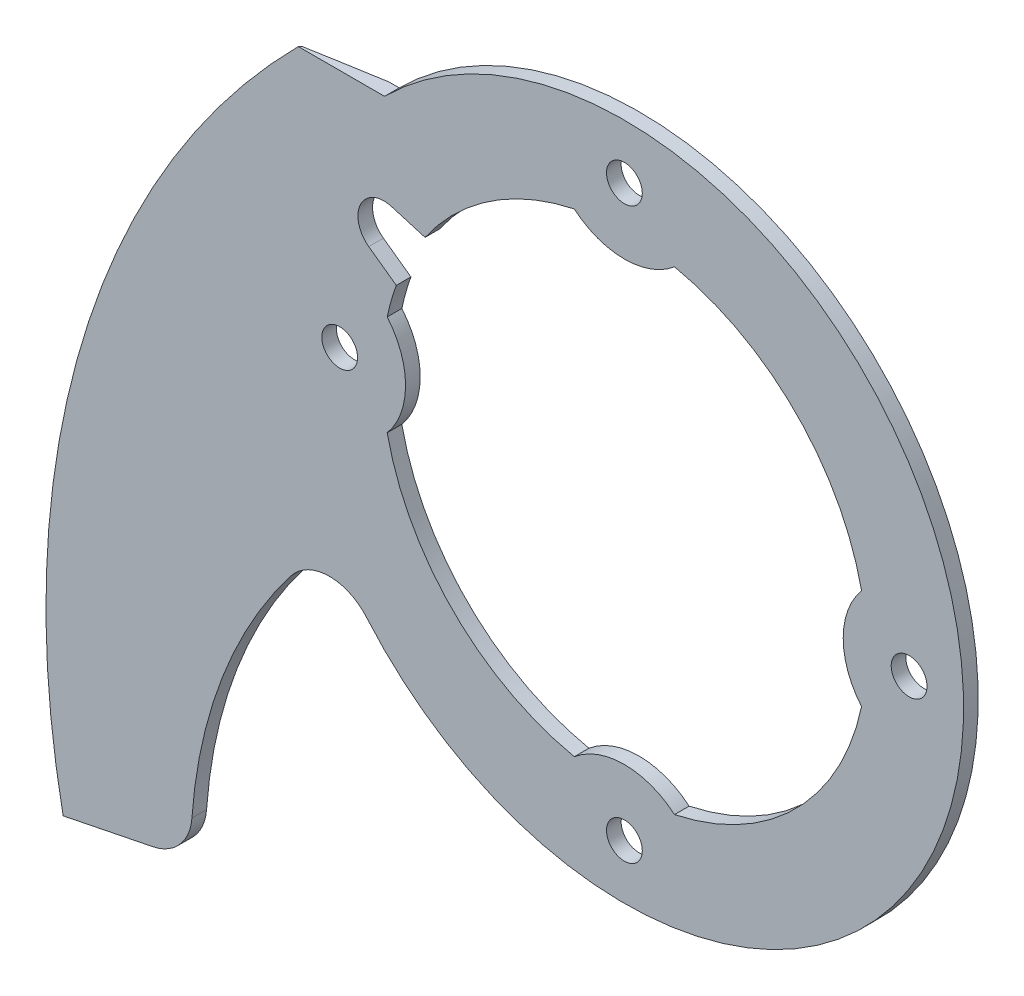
SolidWorks part; units mm, degrees
ref_plane "Plane1" through (0, 0, 0) normal (0, 0, 1) x (1, 0, 0)
ref_plane "Plane2" through (0, 0, 0) normal (0, 1, 0) x (1, 0, 0)
ref_plane "Plane3" through (0, 0, 0) normal (1, 0, 0) x (0, 0, -1)
sketch "top blade profile" plane through (0, 0, 0) normal (0, 0, 1) x (1, 0, 0)
  line L2 (-15.7137, 6.2585) -> (-14.0211, 5.0417)
  line L3 (-12.2523, 8.4789) -> (-14.3262, 9.092)
  line L4 (-15.7137, 6.2585) -> (-14.0211, 5.0417)
  line L5 (-12.2523, 8.4789) -> (-14.3262, 9.092)
  line L12 (0, 0) -> (-30, 30) construction
  line L13 (0, 0) -> (-24.3334, -14.5781) construction
  line L14 (-14.7432, 14.7432) -> (-20.0432, 14.7432)
  line L15 (-34.4973, -33.4353) -> (-26.6559, -31.8505)
  line L16 (-20.0432, 14.7432) -> (-34.4973, -33.4353) construction
  line L17 (-34.4973, -33.4353) -> (-30.4881, -53.2721) construction
  arc A0 (2.0589, -20.7481) -> (3.4672, 20.5597) centre (0, 0) ccw construction
  arc A1 (-2.0589, 20.7481) -> (-3.4672, -20.5597) centre (0, 0) ccw construction
  arc A2 (-3.4672, -20.5597) -> (3.4672, 20.5597) centre (0, 0) ccw
  arc A3 (3.4672, 20.5597) -> (-14.7432, 14.7432) centre (0, 0) ccw
  arc A4 (-20.0432, 14.7432) -> (-34.4973, -33.4353) centre (17.7955, -22.8664) ccw
  arc A5 (-26.6559, -31.8505) -> (-17.8858, -10.7154) centre (2.814, -31.6919) cw
  arc A8 (-17.8858, -10.7154) -> (-3.4672, -20.5597) centre (0, 0) ccw
  circle A9 centre (-17.5, 0) radius 1.1
  arc A10 (14.5781, 3.0805) -> (3.0805, 14.5781) centre (0, 0) ccw
  arc A11 (14.5781, 3.0805) -> (14.5781, -3.0805) centre (18.22, 0) ccw
  arc A12 (3.0805, -14.5781) -> (14.5781, -3.0805) centre (0, 0) ccw
  arc A13 (3.0805, -14.5781) -> (-3.0805, -14.5781) centre (0, -18.22) ccw
  arc A14 (-14.5781, -3.0805) -> (-3.0805, -14.5781) centre (0, 0) ccw
  arc A15 (-14.5781, -3.0805) -> (-14.5781, 3.0805) centre (-18.22, 0) ccw
  arc A16 (-14.0211, 5.0417) -> (-14.5781, 3.0805) centre (0, 0) ccw
  arc A17 (-14.3262, 9.092) -> (-15.7137, 6.2585) centre (-14.7798, 7.5577) ccw
  arc A18 (-3.0805, 14.5781) -> (-12.2523, 8.4789) centre (0, 0) ccw
  arc A19 (-3.0805, 14.5781) -> (3.0805, 14.5781) centre (0, 18.22) ccw
  arc A20 (14.5781, 3.0805) -> (3.0805, 14.5781) centre (0, 0) ccw
  arc A21 (14.5781, 3.0805) -> (14.5781, -3.0805) centre (18.22, 0) ccw
  arc A22 (3.0805, -14.5781) -> (14.5781, -3.0805) centre (0, 0) ccw
  arc A23 (3.0805, -14.5781) -> (-3.0805, -14.5781) centre (0, -18.22) ccw
  arc A24 (-14.5781, -3.0805) -> (-3.0805, -14.5781) centre (0, 0) ccw
  arc A25 (-14.5781, -3.0805) -> (-14.5781, 3.0805) centre (-18.22, 0) ccw
  arc A26 (-14.0211, 5.0417) -> (-14.5781, 3.0805) centre (0, 0) ccw
  arc A27 (-14.3262, 9.092) -> (-15.7137, 6.2585) centre (-14.7798, 7.5577) ccw
  arc A28 (-3.0805, 14.5781) -> (-12.2523, 8.4789) centre (0, 0) ccw
  arc A29 (-3.0805, 14.5781) -> (3.0805, 14.5781) centre (0, 18.22) ccw
  circle A30 centre (-17.5, 0) radius 1.1
  circle A31 centre (0, -17.5) radius 1.1
  circle A32 centre (0, -17.5) radius 1.1
  circle A33 centre (17.5, 0) radius 1.1
  circle A34 centre (17.5, 0) radius 1.1
  circle A35 centre (0, 17.5) radius 1.1
  circle A36 centre (0, 17.5) radius 1.1
  dimension "D6" = 5.3
  dimension "D7" = 50.3
  dimension "D8" = 38
  dimension "D9" = 8
  dimension "D1" = 0.6
  dimension "D2" = 0.1
  dimension "D3" = 0.1
  dimension "D4" = 0.1
  dimension "D5" = 0.1
extrude "basic blade shape" add sketch "top blade profile" along normal blind 0.9
sketch "grind path" plane through (0, 0, 0.9) normal (0, 0, 1) x (1, 0, 0)
  arc A0 (-20.0432, 14.7432) -> (-34.4973, -33.4353) centre (17.7955, -22.8664) ccw construction
  arc A1 (-14.282, 19.7631) -> (-34.4973, -33.4353) centre (17.7955, -22.8664) ccw
sketch "Sketch1" plane through (5.1386, -25.4245, 0) normal (0.1981, -0.9802, 0) x (0.9802, 0.1981, 0)
  line L0 (-40.4373, 0) -> (-40.4373, 0.8)
  line L1 (-40.4373, 0.9) -> (-40.4373, 0) construction
  line L2 (-40.4373, 0.8) -> (-37.2373, 0)
  line L3 (-40.4373, 0) -> (-32.4373, 0) construction
  line L4 (-37.2373, 0) -> (-40.4373, 0)
  dimension "D1" = 0.1
  dimension "D2" = 3.2
sweep "blade grind" cut profiles "Sketch1" path "grind path"
chamfer "edge grind" distance 0.072 angle 45
fillet "blade root fillet" radius 3
fillet "blade end fillet" radius 3
